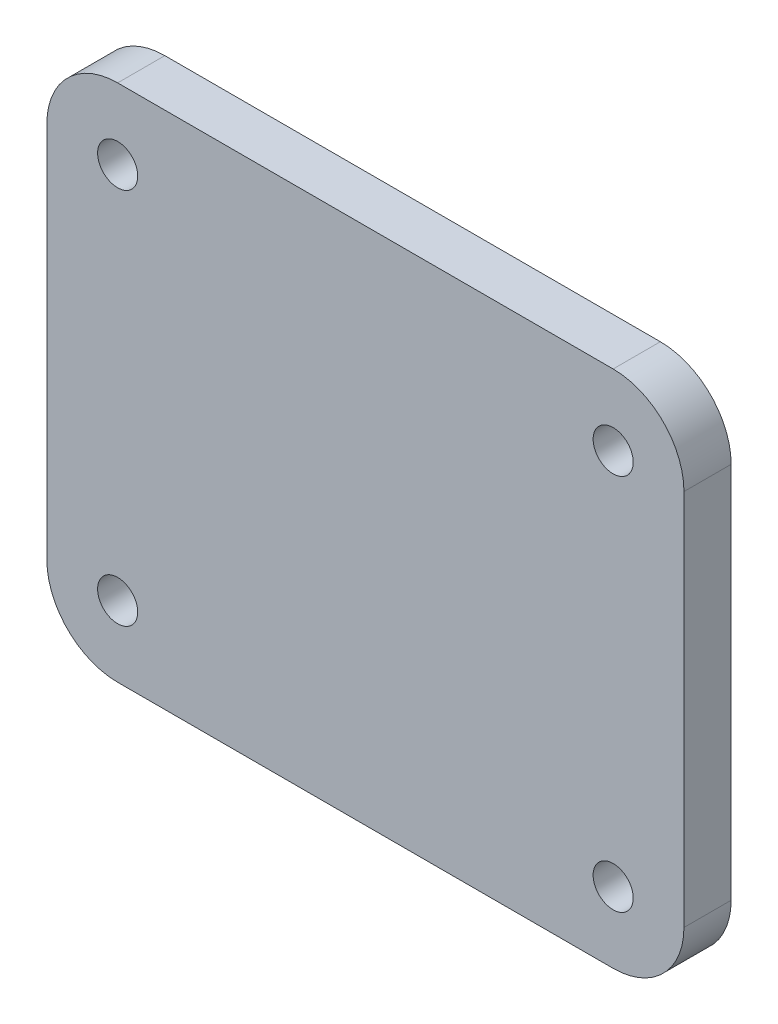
SolidWorks part; units mm, degrees
ref_plane "Plan de face" through (0, 0, 0) normal (0, 0, 1) x (1, 0, 0)
ref_plane "Plan de dessus" through (0, 0, 0) normal (0, 1, 0) x (1, 0, 0)
ref_plane "Plan de droite" through (0, 0, 0) normal (1, 0, 0) x (0, 0, -1)
sketch "Esquisse1" plane through (0, 0, 0) normal (0, 0, 1) x (1, 0, 0)
  line L1 (-67.5, 55) -> (67.5, 55)
  line L2 (-67.5, 55) -> (-67.5, -55)
  line L3 (-67.5, -55) -> (67.5, -55)
  line L4 (67.5, 55) -> (67.5, -55)
  point P4 (0, 55)
  point P6 (67.5, 0)
  dimension "D1" = 135
  dimension "D2" = 110
extrude "Boss.-Extru.1" add sketch "Esquisse1" along normal blind 10
hole_wizard "Trou taraudé M101" positions "Esquisse6" profile "Esquisse5" tap size "M10" standard "Iso"
sketch "Esquisse6" plane through (0, 0, 10) normal (0, 0, 1) x (1, 0, 0)
  line L0 (67.5, 55) -> (-67.5, 55) construction
  line L1 (-67.5, 55) -> (-67.5, -55) construction
  point P0 (-52.5, 40)
  dimension "D1" = 15
  dimension "D2" = 15
sketch "Esquisse5" plane through (-52.5, 40, 10) normal (1, 0, 0) x (0, -1, 0)
  line L0 (0, 0) -> (0, 10)
  line L1 (0, 10) -> (4.25, 10)
  line L2 (4.25, 10) -> (4.25, 0)
  line L5 (4.25, 0) -> (0, 0)
  line L11 (0, -6.35) -> (0, 107.95) construction
  dimension "Diamètre du trou pour taraudage jusqu'au prochain" = 8.5
  dimension "Profondeur du trou pour taraudage jusqu'au prochain" = 10
pattern_linear "Répétition linéaire1" count 2 spacing 105 along (1, 0, 0) count 2 spacing 80 along (0, -1, 0) of "Trou taraudé M101"
fillet "Congé1" radius 15 4 edges at (67.5, -55, 5) (-67.5, -55, 5) (67.5, 55, 5) (-67.5, 55, 5)
